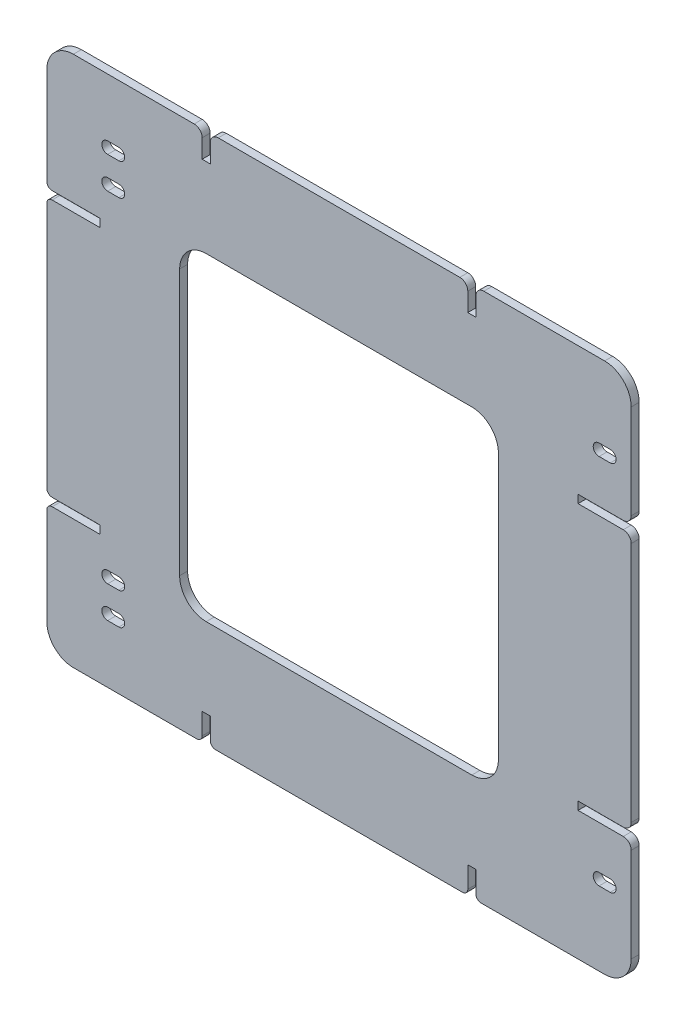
SolidWorks part; units mm, degrees
ref_plane "前视基准面" through (0, 0, 0) normal (0, 0, 1) x (1, 0, 0)
ref_plane "上视基准面" through (0, 0, 0) normal (0, 1, 0) x (1, 0, 0)
ref_plane "右视基准面" through (0, 0, 0) normal (1, 0, 0) x (0, 0, -1)
sketch "草图1" plane through (0, 0, 0) normal (0, 0, 1) x (1, 0, 0)
  line L1 (-110, 100) -> (110, 100)
  line L2 (-110, 100) -> (-110, -100)
  line L3 (-110, -100) -> (110, -100)
  line L4 (110, 100) -> (110, -100)
  line L5 (-110, 100) -> (110, -100) construction
  line L6 (-110, -100) -> (110, 100) construction
  point P0 (0, 0)
  dimension "D1" = 200
  dimension "D2" = 220
extrude "凸台-拉伸1" add sketch "草图1" along normal blind 3
hole_wizard "Ø4.2 (4.2) 直径孔1" positions "草图2" profile "草图3" hole size "Ø4.2" standard "GB"
sketch "草图2" plane through (0, 0, 3) normal (0, 0, 1) x (1, 0, 0)
  point P0 (-85, 76)
  point P3 (-85, 64)
  point P12 (-85, -76)
  point P15 (-85, -64)
  point P26 (100, -70)
  point P29 (100, 70)
sketch "草图3" plane through (-85, 76, 3) normal (1, 0, 0) x (0, -1, 0)
  line L0 (0, 0) -> (0, 3)
  line L1 (0, 3) -> (2.1, 3)
  line L2 (2.1, 3) -> (2.1, 0)
  line L5 (2.1, 0) -> (0, 0)
  line L11 (0, -6.35) -> (0, 107.95) construction
  dimension "通孔孔直径" = 4.2
  dimension "通孔孔深度" = 3
fillet "圆角1" radius 10 4 edges at (110, -100, 1.5) (-110, 100, 1.5) (110, 100, 1.5) (-110, -100, 1.5)
sketch "草图4" plane through (0, 0, 3) normal (0, 0, 1) x (1, 0, 0)
  line L1 (-60, -60) -> (60, -60)
  line L2 (-60, -60) -> (-60, 60)
  line L3 (-60, 60) -> (60, 60)
  line L4 (60, -60) -> (60, 60)
  line L5 (-60, -60) -> (60, 60) construction
  line L6 (-60, 60) -> (60, -60) construction
  point P0 (0, 0)
  dimension "D1" = 120
  dimension "D2" = 120
extrude "切除-拉伸1" cut sketch "草图4" against normal blind 3
fillet "圆角2" radius 10 4 edges at (-60, 60, 1.5) (60, 60, 1.5) (60, -60, 1.5) (-60, -60, 1.5)
sketch "草图5" plane through (0, 0, 3) normal (0, 0, 1) x (1, 0, 0)
  line L0 (-110, 90) -> (-110, -90) construction
  line L1 (-130, 51.525) -> (-90, 51.525)
  line L2 (-130, 51.525) -> (-130, 48.475)
  line L3 (-130, 48.475) -> (-90, 48.475)
  line L4 (-90, 51.525) -> (-90, 48.475)
  line L5 (-130, 51.525) -> (-90, 48.475) construction
  line L6 (-130, 48.475) -> (-90, 51.525) construction
  line L7 (-100, -100) -> (100, -100) construction
  line L8 (-130, -48.475) -> (-90, -48.475)
  line L9 (-130, -48.475) -> (-130, -51.525)
  line L10 (-130, -51.525) -> (-90, -51.525)
  line L11 (-90, -48.475) -> (-90, -51.525)
  line L12 (-130, -48.475) -> (-90, -51.525) construction
  line L13 (-130, -51.525) -> (-90, -48.475) construction
  line L14 (-51.525, -110) -> (-48.475, -110)
  line L15 (-51.525, -110) -> (-51.525, -90)
  line L16 (-51.525, -90) -> (-48.475, -90)
  line L17 (-48.475, -110) -> (-48.475, -90)
  line L18 (-51.525, -110) -> (-48.475, -90) construction
  line L19 (-51.525, -90) -> (-48.475, -110) construction
  line L20 (-60, 0) -> (60, 0) construction
  line L21 (48.475, -110) -> (51.525, -110)
  line L22 (48.475, -110) -> (48.475, -90)
  line L23 (48.475, -90) -> (51.525, -90)
  line L24 (51.525, -110) -> (51.525, -90)
  line L25 (48.475, -110) -> (51.525, -90) construction
  line L26 (48.475, -90) -> (51.525, -110) construction
  line L27 (-60, 50) -> (-60, -50) construction
  line L28 (60, -50) -> (60, 50) construction
  line L29 (0, 60) -> (0, -60) construction
  line L32 (130, -51.525) -> (90, -48.475) construction
  line L33 (130, -48.475) -> (90, -51.525) construction
  line L34 (130, 48.475) -> (90, 51.525) construction
  line L35 (130, 51.525) -> (90, 48.475) construction
  line L36 (90, -48.475) -> (90, -51.525)
  line L37 (130, -51.525) -> (90, -51.525)
  line L38 (130, -48.475) -> (130, -51.525)
  line L39 (130, -48.475) -> (90, -48.475)
  line L40 (90, 51.525) -> (90, 48.475)
  line L41 (130, 48.475) -> (90, 48.475)
  line L42 (130, 51.525) -> (130, 48.475)
  line L43 (130, 51.525) -> (90, 51.525)
  line L44 (48.475, 90) -> (51.525, 110) construction
  line L45 (48.475, 110) -> (51.525, 90) construction
  line L46 (-51.525, 90) -> (-48.475, 110) construction
  line L47 (-51.525, 110) -> (-48.475, 90) construction
  line L48 (51.525, 110) -> (51.525, 90)
  line L49 (48.475, 90) -> (51.525, 90)
  line L50 (48.475, 110) -> (48.475, 90)
  line L51 (48.475, 110) -> (51.525, 110)
  line L52 (-48.475, 110) -> (-48.475, 90)
  line L53 (-51.525, 90) -> (-48.475, 90)
  line L54 (-51.525, 110) -> (-51.525, 90)
  line L55 (-51.525, 110) -> (-48.475, 110)
  line L56 (50, 60) -> (-50, 60) construction
  line L57 (-50, -60) -> (50, -60) construction
  point P0 (-110, 50)
  point P7 (-110, -50)
  point P12 (-50, -100)
  point P19 (50, -100)
  point P45 (110, -50)
  point P46 (110, 50)
  point P55 (50, 100)
  point P56 (-50, 100)
  dimension "D1" = 40
  dimension "D2" = 40
  dimension "D3" = 20
  dimension "D4" = 20
  dimension "D5" = 3.05
  dimension "D6" = 3.05
  dimension "D7" = 3.05
  dimension "D8" = 3.05
  dimension "D9" = 100
  dimension "D10" = 50
  dimension "D11" = 100
  dimension "D12" = 50
extrude "切除-拉伸2" cut sketch "草图5" against normal blind 3
fillet "圆角4" radius 2 8 edges at (-110, -51.525, 1.5) (-110, -48.475, 1.5) (-48.475, -100, 1.5) (-51.525, -100, 1.5) (51.525, -100, 1.5) (48.475, -100, 1.5) (-110, 48.475, 1.5) (-110, 51.525, 1.5)
fillet "圆角5" radius 3 8 edges at (48.475, 100, 1.5) (51.525, 100, 1.5) (-48.475, 100, 1.5) (-51.525, 100, 1.5) (110, -51.525, 1.5) (110, -48.475, 1.5) (110, 48.475, 1.5) (110, 51.525, 1.5)
sketch "草图6" plane through (0, 0, 3) normal (0, 0, 1) x (1, 0, 0)
  line L0 (-87.1, 76) -> (-82.9, 76) construction
  line L1 (-87.1, 78.2) -> (-82.9, 78.2)
  line L2 (-87.1, 73.8) -> (-82.9, 73.8)
  line L3 (-87.1, 64) -> (-82.9, 64) construction
  line L4 (-87.1, 66.2) -> (-82.9, 66.2)
  line L5 (-87.1, 61.8) -> (-82.9, 61.8)
  line L6 (-87.1, -64) -> (-82.9, -64) construction
  line L7 (-87.1, -61.8) -> (-82.9, -61.8)
  line L8 (-87.1, -66.2) -> (-82.9, -66.2)
  line L9 (-87.1, -76) -> (-82.9, -76) construction
  line L10 (-87.1, -73.8) -> (-82.9, -73.8)
  line L11 (-87.1, -78.2) -> (-82.9, -78.2)
  line L12 (97.9, 70) -> (102.1, 70) construction
  line L13 (97.9, 72.2) -> (102.1, 72.2)
  line L14 (97.9, 67.8) -> (102.1, 67.8)
  line L15 (97.9, -70) -> (102.1, -70) construction
  line L16 (97.9, -67.8) -> (102.1, -67.8)
  line L17 (97.9, -72.2) -> (102.1, -72.2)
  circle A0 centre (-85, 76) radius 2.1 construction
  arc A1 (-87.1, 78.2) -> (-87.1, 73.8) centre (-87.1, 76) ccw
  arc A2 (-82.9, 73.8) -> (-82.9, 78.2) centre (-82.9, 76) ccw
  circle A3 centre (-85, 64) radius 2.1 construction
  arc A4 (-87.1, 66.2) -> (-87.1, 61.8) centre (-87.1, 64) ccw
  arc A5 (-82.9, 61.8) -> (-82.9, 66.2) centre (-82.9, 64) ccw
  circle A6 centre (-85, -64) radius 2.1 construction
  arc A7 (-87.1, -61.8) -> (-87.1, -66.2) centre (-87.1, -64) ccw
  arc A8 (-82.9, -66.2) -> (-82.9, -61.8) centre (-82.9, -64) ccw
  circle A9 centre (-85, -76) radius 2.1 construction
  arc A10 (-87.1, -73.8) -> (-87.1, -78.2) centre (-87.1, -76) ccw
  arc A11 (-82.9, -78.2) -> (-82.9, -73.8) centre (-82.9, -76) ccw
  circle A12 centre (100, 70) radius 2.1 construction
  arc A13 (97.9, 72.2) -> (97.9, 67.8) centre (97.9, 70) ccw
  arc A14 (102.1, 67.8) -> (102.1, 72.2) centre (102.1, 70) ccw
  circle A15 centre (100, -70) radius 2.1 construction
  arc A16 (97.9, -67.8) -> (97.9, -72.2) centre (97.9, -70) ccw
  arc A17 (102.1, -72.2) -> (102.1, -67.8) centre (102.1, -70) ccw
  point P5 (-85, 76)
  point P10 (-85, 64)
  point P19 (-85, -64)
  point P29 (-85, -76)
  point P39 (100, 70)
  point P48 (100, -70)
  dimension "D1" = 2.2
  dimension "D2" = 2.2
  dimension "D3" = 2.2
  dimension "D4" = 2.2
  dimension "D5" = 2.2
  dimension "D6" = 2.2
extrude "切除-拉伸3" cut sketch "草图6" against normal blind 10
